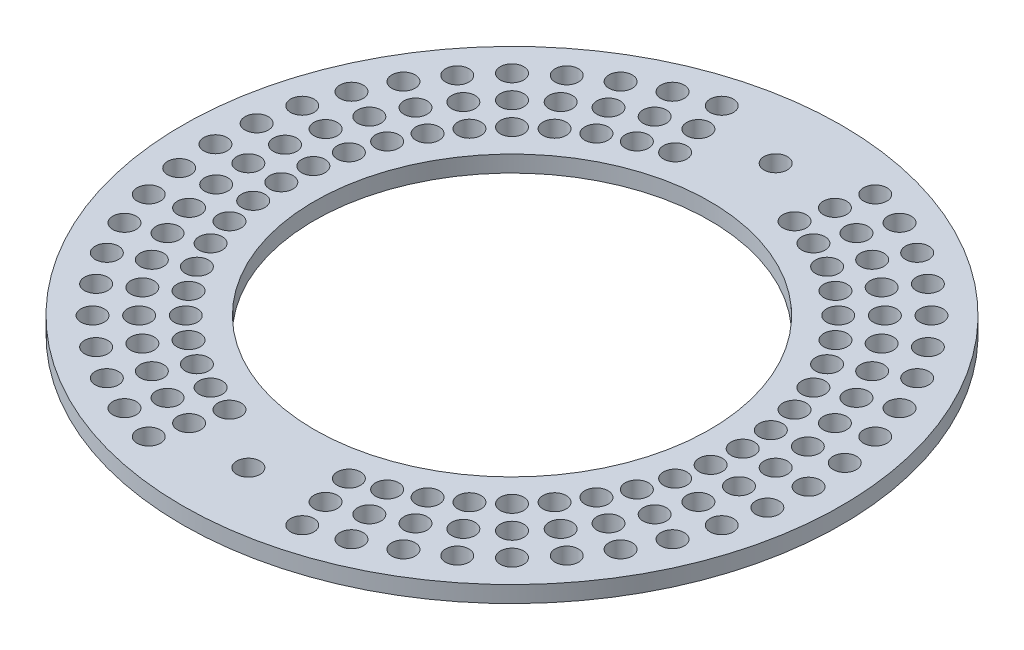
SolidWorks part; units mm, degrees
ref_plane "Front Plane" through (0, 0, 0) normal (0, 0, 1) x (1, 0, 0)
ref_plane "Top Plane" through (0, 0, 0) normal (0, 1, 0) x (1, 0, 0)
ref_plane "Right Plane" through (0, 0, 0) normal (1, 0, 0) x (0, 0, -1)
sketch "Sketch1" plane through (0, 0, 0) normal (0, 1, 0) x (1, 0, 0)
  circle A0 centre (0, 0) radius 38.1
  circle A1 centre (0, 0) radius 63.5
  dimension "D1" = 127
  dimension "D2" = 76.2
extrude "Boss-Extrude1" add sketch "Sketch1" along normal blind 3.175
sketch "Sketch2" plane through (0, 3.175, 0) normal (0, 1, 0) x (1, 0, 0)
  line L0 (0, 50.8) -> (0, -50.8) construction
  circle A0 centre (0, 50.8) radius 2.2479
  circle A1 centre (0, -50.8) radius 2.2479
  point P4 (0, 0)
  dimension "D1" = 4.4958
  dimension "D2" = 101.6
extrude "Cut-Extrude1" cut sketch "Sketch2" against normal through all
sketch "Sketch3" plane through (0, 3.175, 0) normal (0, 1, 0) x (1, 0, 0)
  line L0 (0, 0) -> (0, 32.5002) construction
  line L1 (0, 0) -> (-14.7915, 55.2027) construction
  circle A0 centre (-14.7915, 55.2027) radius 2.2479
  circle A1 centre (-13.148, 49.069) radius 2.2479
  circle A2 centre (-11.5045, 42.9354) radius 2.2479
  circle A3 centre (0, 50.8) radius 2.2479 construction
  circle A4 centre (0, 0) radius 44.45 construction
  circle A5 centre (0, 0) radius 50.8 construction
  circle A6 centre (0, 0) radius 57.15 construction
  point P14 (-15.2028, 41.7693)
  point P15 (0, 0)
  dimension "D1" = 101.6
  dimension "D2" = 114.3
  dimension "D3" = 88.9
  dimension "D4" = 15
extrude "Cut-Extrude2" cut sketch "Sketch3" against normal through all
pattern_circular "CirPattern1" count 21 every 7.5 about axis through (0, 0, 0) along (0, 1, 0) of "Cut-Extrude2"
mirror "Mirror1" about plane through (0, 0, 0) normal (1, 0, 0) of "CirPattern1", "Cut-Extrude2"
